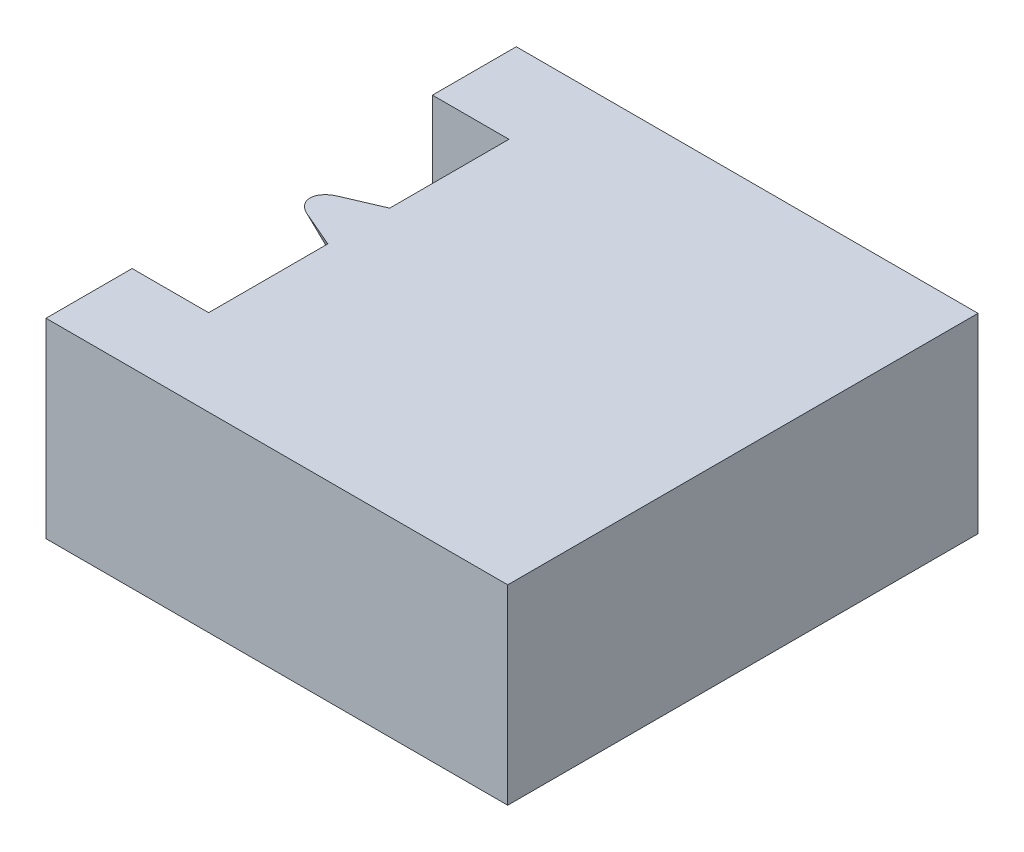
SolidWorks part; units mm, degrees
ref_plane "Vorne" through (0, 0, 0) normal (0, 0, 1) x (1, 0, 0)
ref_plane "Oben" through (0, 0, 0) normal (0, 1, 0) x (1, 0, 0)
ref_plane "Rechts" through (0, 0, 0) normal (1, 0, 0) x (0, 0, -1)
sketch "Skizze1" plane through (0, 0, 0) normal (0, 1, 0) x (1, 0, 0)
  line L1 (-44.6813, 23.83) -> (41.1068, 23.83)
  line L2 (-44.6813, 23.83) -> (-44.6813, -33.362)
  line L3 (-44.6813, -33.362) -> (41.1068, -33.362)
  line L4 (41.1068, 23.83) -> (41.1068, -33.362)
extrude "Linear austragen1" add sketch "Skizze1" along normal blind 12.5
sketch "Skizze2" plane through (0, 0, 0) normal (0, -1, 0) x (1, 0, 0)
  line L0 (-17.7, 15.4212) -> (-10.6911, 15.4212)
  line L1 (-17.7, 21.0591) -> (12.5298, 21.0591)
  line L2 (-17.7, 21.0591) -> (-17.7, 15.4212)
  line L3 (-17.7, -9.7295) -> (12.5298, -9.7295)
  line L4 (12.5298, 21.0591) -> (12.5298, -9.7295)
  line L5 (-10.6911, 15.4212) -> (-10.6911, -4.2409)
  line L6 (-10.6911, -4.2409) -> (-17.7, -4.2409)
  line L7 (-17.7, -4.2409) -> (-17.7, -9.7295)
extrude "Linear austragen2" add sketch "Skizze2" along normal blind 12.5
fillet "Verrundung1" radius 2 1 edges at (-10.6911, 0, 5.5902)
ref_plane "Ebene1" through (0, 0, 5.5902) normal (0, 0, -1) x (-1, 0, 0)
sketch "Skizze3" plane through (0, 0, 5.5902) normal (0, 0, -1) x (-1, 0, 0)
  line L0 (9.4978, -6.0573) -> (17.9482, 1.9673)
ref_plane "Ebene2" through (-9.4978, -6.0573, 5.5902) normal (-0.7251, 0.6886, 0) x (0, 0, 1)
sketch "Skizze4" plane through (-9.4978, -6.0573, 5.5902) normal (-0.7251, 0.6886, 0) x (0, 0, 1)
  line L0 (0, 0) -> (0, 4.5067) construction
  line L1 (-1.006, 0.5584) -> (-2.9252, 3.6381)
  line L2 (1.006, 0.5584) -> (2.9252, 3.6381)
  line L3 (-2.9252, 3.6381) -> (2.9252, 3.6381)
  arc A0 (1.006, 0.5584) -> (-1.006, 0.5584) centre (0, 1.1853) cw
  point P8 (0, 3.6381)
extrude "Linear austragen3" add sketch "Skizze4" along normal up to next
sketch "Skizze5" plane through (0, 0, -23.83) normal (0, 0, -1) x (-1, 0, 0)
  line L4 (-41.1068, 0) -> (44.6813, 0)
  line L5 (44.6813, 0) -> (44.6813, 12.5)
  line L6 (44.6813, 12.5) -> (-41.1068, 12.5)
  line L7 (-41.1068, 12.5) -> (-41.1068, 0)
  line L8 (-41.1068, 0) -> (44.6813, 0)
  line L9 (44.6813, 0) -> (44.6813, 12.5)
  line L10 (44.6813, 12.5) -> (-41.1068, 12.5)
  line L11 (-41.1068, 12.5) -> (-41.1068, 0)
  dimension "D1" = 0
extrude "Schnitt-Linear austragen1" cut sketch "Skizze5" against normal up to surface (57.1921 mm away)
sketch "Skizze6" plane through (0, 0, 0) normal (0, 1, 0) x (-1, 0, 0)
  line L11 (17.7, -9.7295) -> (17.7, -4.2409)
  line L12 (17.7, -4.2409) -> (12.6911, -4.2409)
  line L13 (12.6911, -4.2409) -> (12.6911, 3.5652)
  line L14 (12.6911, 3.5652) -> (15.0656, 4.5842)
  line L15 (12.6911, 3.5652) -> (15.0656, 4.5842)
  line L16 (12.6911, 7.6151) -> (12.6911, 15.4212)
  line L17 (12.6911, 15.4212) -> (17.7, 15.4212)
  line L18 (17.7, 15.4212) -> (17.7, 21.0591)
  line L19 (17.7, 21.0591) -> (-12.5298, 21.0591)
  line L20 (-12.5298, 21.0591) -> (-12.5298, -9.7295)
  line L21 (-12.5298, -9.7295) -> (17.7, -9.7295)
  line L22 (17.7, -9.7295) -> (17.7, -4.2409)
  line L23 (17.7, -4.2409) -> (12.6911, -4.2409)
  line L24 (12.6911, -4.2409) -> (12.6911, 3.5652)
  line L25 (15.0656, 6.5961) -> (12.6911, 7.6151)
  line L26 (15.0656, 6.5961) -> (12.6911, 7.6151)
  line L27 (12.6911, 7.6151) -> (12.6911, 15.4212)
  line L28 (12.6911, 15.4212) -> (17.7, 15.4212)
  line L29 (17.7, 15.4212) -> (17.7, 21.0591)
  line L30 (17.7, 21.0591) -> (-12.5298, 21.0591)
  line L31 (-12.5298, 21.0591) -> (-12.5298, -9.7295)
  line L32 (-12.5298, -9.7295) -> (17.7, -9.7295)
  ellipse E1 centre (14.1552, 5.5902) end of major axis (12.4339, 5.5902) minor radius 1.1853 (15.0656, 4.5842) -> (15.0656, 6.5961) ccw
  ellipse E2 centre (14.1552, 5.5902) end of major axis (12.4339, 5.5902) minor radius 1.1853 (15.0656, 4.5842) -> (15.0656, 6.5961) ccw
  dimension "D1" = 0
